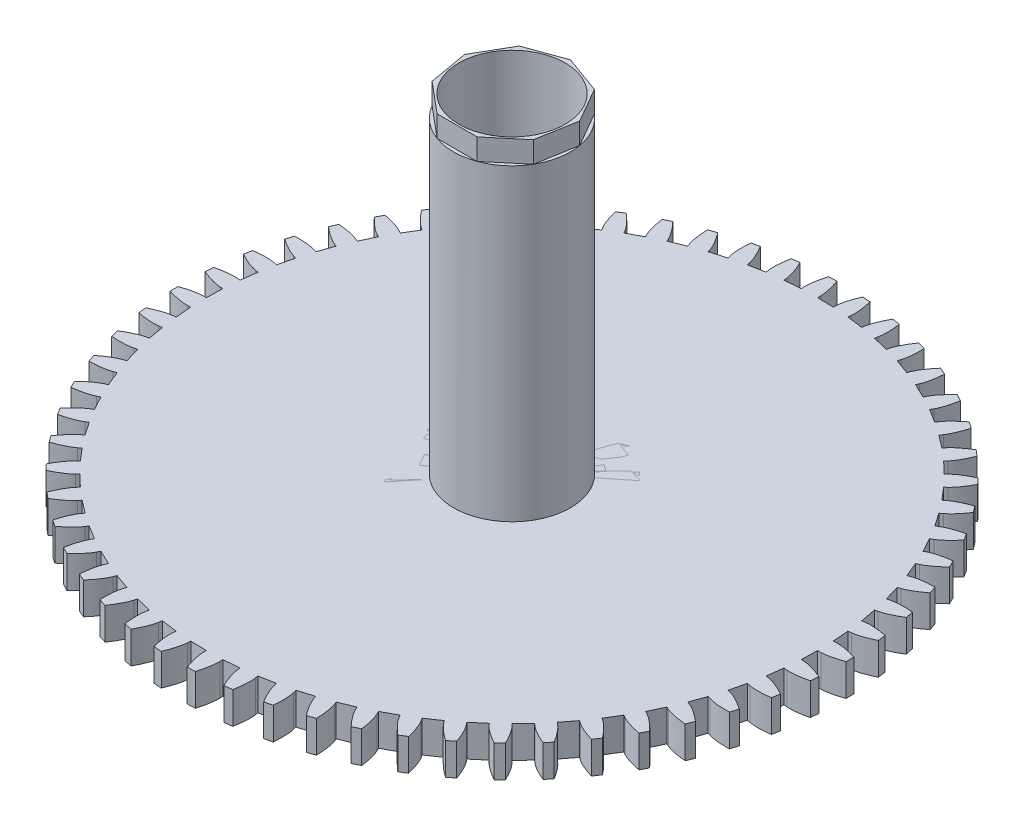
SolidWorks part; units mm, degrees
ref_plane "Front Plane" through (0, 0, 0) normal (0, 0, 1) x (1, 0, 0)
ref_plane "Top Plane" through (0, 0, 0) normal (0, 1, 0) x (1, 0, 0)
ref_plane "Right Plane" through (0, 0, 0) normal (1, 0, 0) x (0, 0, -1)
sketch "Sketch1" plane through (0, 0, 0) normal (0, 1, 0) x (1, 0, 0)
  line L0 (0, 0) -> (0, 14.5222) construction
  line L1 (0, 0) -> (-14.5222, 0) construction
  line L2 (0, 0) -> (-15.4947, -0.4057) construction
  line L3 (0, 0) -> (-14.5023, -0.76) construction
  line L4 (0, 0) -> (-14.4427, -1.518) construction
  circle A0 centre (0, 0) radius 15 construction
  circle A1 centre (0, 0) radius 14.5222 construction
  circle A2 centre (0, 0) radius 14.375 construction
  circle A3 centre (0, 0) radius 15.5 construction
  spline S0 degree 4 poles (-14.5222, 0) (-14.5474, 0) (-14.6179, -0.0026) (-14.7508, -0.0177) (-14.9656, -0.0568) (-15.2352, -0.1274) (-15.5771, -0.2425) (-15.9699, -0.4077) (-16.3888, -0.6197) (-16.8288, -0.8819) (-17.2522, -1.1709) (-17.6587, -1.4833) (-18.0484, -1.8162) (-18.5012, -2.2426) (-19.0162, -2.7882) (-19.5743, -3.4671) (-20.1529, -4.291) (-20.6802, -5.1708) (-21.1469, -6.0836) (-21.5035, -6.9074) (-21.773, -7.6266) (-21.9741, -8.236) (-22.1209, -8.7246) (-22.2874, -9.3478) (-22.4308, -9.9638) (-22.5527, -10.6055) (-22.6716, -11.3455) (-22.7509, -12.0161) (-22.806, -12.5943) (-22.8507, -13.4193) (-22.8604, -13.7954) (-22.8666, -14.374) (-22.8585, -14.6717) (-22.8548, -14.932) (-22.8482, -15.0561) (-22.8445, -15.1782) (-22.8421, -15.2291) knots 0 0 0 0 0 0.005377 0.015084 0.028532 0.04661 0.064855 0.092111 0.119476 0.146842 0.174209 0.201575 0.228941 0.256307 0.307035 0.361767 0.4165 0.471232 0.525964 0.580697 0.608063 0.635429 0.662795 0.690161 0.744894 0.77226 0.799626 0.854358 0.881725 0.909091 0.954545 0.965909 0.977273 0.988636 1 1 1 1 1 construction
  spline S1 degree 4 poles (-14.5222, 0) (-14.5474, 0) (-14.6179, -0.0026) (-14.7508, -0.0177) (-14.9656, -0.0568) (-15.2352, -0.1274) (-15.5771, -0.2425) (-15.9699, -0.4077) (-16.3888, -0.6197) (-16.8288, -0.8819) (-17.2522, -1.1709) (-17.6587, -1.4833) (-18.0484, -1.8162) (-18.5012, -2.2426) (-19.0162, -2.7882) (-19.5743, -3.4671) (-20.1529, -4.291) (-20.6802, -5.1708) (-21.1469, -6.0836) (-21.5035, -6.9074) (-21.773, -7.6266) (-21.9741, -8.236) (-22.1209, -8.7246) (-22.2874, -9.3478) (-22.4308, -9.9638) (-22.5527, -10.6055) (-22.6716, -11.3455) (-22.7509, -12.0161) (-22.806, -12.5943) (-22.8376, -13.1773) (-22.8474, -13.4103) (-22.8512, -13.5267) knots 0 0 0 0 0 0.005377 0.015084 0.028532 0.04661 0.064855 0.092111 0.119476 0.146842 0.174209 0.201575 0.228941 0.256307 0.307035 0.361767 0.4165 0.471232 0.525964 0.580697 0.608063 0.635429 0.662795 0.690161 0.744894 0.77226 0.799626 0.854358 0.881725 0.909091 0.909091 0.909091 0.909091 0.909091
  dimension "D1" = 31
  dimension "D2" = 30
  dimension "D3" = 29.0444
  dimension "D4" = 28.75
  dimension "D5" = 14.5222
  dimension "D6" = 1.5
  dimension "D7" = 3
  dimension "D8" = 6
sketch "Sketch2" plane through (0, 0, 0) normal (0, 1, 0) x (1, 0, 0)
  line L0 (0, 0) -> (-15.4947, -0.4057) construction
  line L1 (0, 0) -> (-15.4947, -0.4057) construction
  line L2 (0, 0) -> (-14.5023, -0.76) construction
  line L3 (0, 0) -> (-14.5222, 0) construction
  line L4 (0, 0) -> (-14.4427, -1.518) construction
  line L5 (0, 0) -> (-14.5023, -0.76) construction
  line L6 (0, 0) -> (-14.5222, 0) construction
  line L7 (0, 0) -> (-14.4427, -1.518) construction
  line L8 (-14.5023, -0.76) -> (-14.3553, -0.7523)
  line L9 (-14.3553, -0.7523) -> (-14.2963, -1.5026)
  line L10 (-14.2963, -1.5026) -> (-14.4427, -1.518) construction
  line L11 (-14.2963, -1.5026) -> (-2.4863, -0.2613)
  line L12 (-14.5222, 0) -> (-2.5, 0)
  circle A0 centre (0, 0) radius 14.375 construction
  circle A1 centre (0, 0) radius 14.5222 construction
  circle A2 centre (0, 0) radius 15 construction
  circle A3 centre (0, 0) radius 15.5 construction
  circle A4 centre (0, 0) radius 14.375 construction
  circle A5 centre (0, 0) radius 14.5222 construction
  circle A6 centre (0, 0) radius 15 construction
  circle A7 centre (0, 0) radius 15.5 construction
  arc A8 (-15.4887, -0.5918) -> (-15.4984, -0.2196) centre (0, 0) cw
  circle A11 centre (0, 0) radius 2.5 construction
  arc A12 (-2.5, 0) -> (-2.4863, -0.2613) centre (0, 0) ccw
  spline S0 degree 4 poles (-106.778, -2998.2103) (-10.1689, -57.3998) (-10.8164, -1.168) (-12.9959, 0.3015) (-14.9656, -0.0568) (-15.2352, -0.1274) (-15.5771, -0.2425) (-15.9699, -0.4077) (-16.3888, -0.6197) (-16.8288, -0.8819) (-17.2522, -1.1709) (-17.6587, -1.4833) (-18.0484, -1.8162) (-18.5012, -2.2426) (-19.0162, -2.7882) (-19.5743, -3.4671) (-20.1529, -4.291) (-20.6802, -5.1708) (-21.1469, -6.0836) (-21.5035, -6.9074) (-21.773, -7.6266) (-21.9741, -8.236) (-22.1209, -8.7246) (-22.2874, -9.3478) (-22.4308, -9.9638) (-22.5527, -10.6055) (-22.6716, -11.3455) (-22.7509, -12.0161) (-23.004, -14.671) (-22.8687, -20.8391) (-19.5685, 58.5384) (-120.7887, -3011.7811) knots -0.380873 -0.380873 -0.380873 -0.380873 -0.380873 0.005377 0.015084 0.028532 0.04661 0.064855 0.092111 0.119476 0.146842 0.174209 0.201575 0.228941 0.256307 0.307035 0.361767 0.4165 0.471232 0.525964 0.580697 0.608063 0.635429 0.662795 0.690161 0.744894 0.77226 0.799626 0.854358 0.881725 1.400556 1.400556 1.400556 1.400556 1.400556 only from (-14.5222, 0) to (-22.8512, -13.5267) construction
  spline S1 degree 4 poles (-14.5222, 0) (-14.5474, 0) (-14.6179, -0.0026) (-14.7508, -0.0177) (-14.9656, -0.0568) (-15.1845, -0.1141) (-15.3565, -0.1691) (-15.4674, -0.2083) (-15.4984, -0.2196) knots 0 0 0 0 0 0.005377 0.015084 0.028532 0.04661 0.053662 0.053662 0.053662 0.053662 0.053662
  spline S2 degree 4 poles (-14.5023, -0.76) (-14.5275, -0.7614) (-14.5981, -0.7625) (-14.7315, -0.7543) (-14.9481, -0.7266) (-15.1696, -0.6807) (-15.3443, -0.6348) (-15.4571, -0.6015) (-15.4887, -0.5918) knots 0 0 0 0 0 0.005377 0.015084 0.028532 0.04661 0.053662 0.053662 0.053662 0.053662 0.053662
  point P21 (-14.3553, -0.7523)
  point P24 (-14.2963, -1.5026)
  dimension "D2" = 5
extrude "Boss-Extrude1" add sketch "Sketch2" along normal blind 1.5
pattern_circular "CirPattern1" count 60 over 360 of "Boss-Extrude1"
sketch "Sketch3" plane through (0, 1.5, 0) normal (0, 1, 0) x (1, 0, 0)
  circle A0 centre (0, 0) radius 2.5
  circle A1 centre (0, 0) radius 2.75
  circle A2 centre (0, 0) radius 2.5 construction
  dimension "D1" = 0.25
extrude "Boss-Extrude2" add sketch "Sketch3" along normal blind 15.5
sketch "Sketch4" plane through (0, 17, 0) normal (0, 1, 0) x (1, 0, 0)
  line L0 (2.3816, -1.375) -> (2.7082, 0.4775)
  line L1 (0, 2.75) -> (-1.7677, 2.1066)
  line L2 (-1.7677, 2.1066) -> (-2.7082, 0.4775)
  line L3 (-2.7082, 0.4775) -> (-2.3816, -1.375)
  line L4 (-2.3816, -1.375) -> (-0.9406, -2.5842)
  line L5 (-0.9406, -2.5842) -> (0.9406, -2.5842)
  line L6 (0.9406, -2.5842) -> (2.3816, -1.375)
  line L7 (2.7082, 0.4775) -> (1.7677, 2.1066)
  line L8 (1.7677, 2.1066) -> (0, 2.75)
  circle A0 centre (0, 0) radius 2.75
  circle A1 centre (0, 0) radius 2.75 construction
extrude "Cut-Extrude2" cut sketch "Sketch4" against normal blind 1 contours L6 M1 | L0 M1 | L7 M1 | L5 M1 | L4 M1 | L3 M1 | L2 M1 | L1 M1 | L8 M1 | A0
equation "\"Module\"= .5"
equation "\"Number of Teeth\"= 60"
equation "\"Pressure Angle\"= 14.5deg"
equation "\"Pitch Diameter\"= \"Number of Teeth\" * \"Module\""
equation "\"Circular Pitch\"= pi * \"Module\""
equation "\"Addendum\"= \"Module\""
equation "\"Dedendum\"= 1.25 * \"Module\""
equation "\"Base Diameter\"= \"Pitch Diameter\" * cos ( \"Pressure Angle\" )"
equation "\"Base Radius\"= \"Base Diameter\" / 2"
equation "\"Width\"= 1.5"
equation "\"Outside Diameter\"= \"Pitch Diameter\" + 2 * \"Addendum\""
equation "\"D1@Sketch1\"=\"Outside Diameter\""
equation "\"D3@Sketch1\"=\"Base Diameter\""
equation "\"Root Diameter\"= \"Pitch Diameter\" - 2 * \"Dedendum\""
equation "\"D4@Sketch1\"=\"Root Diameter\""
equation "\"Tooth Angle\"= 360 / \"Number of Teeth\""
equation "\"D6@Sketch1\"=\"Tooth Angle\"/4"
equation "\"D7@Sketch1\"=\"Tooth Angle\"/2"
equation "\"D8@Sketch1\"=\"Tooth Angle\""
equation "\"D2@Sketch1\" = \"Pitch Diameter\""
equation "\"Shaft Diameter\"= 5"
equation "\"D1@CirPattern1\" = \"Number of Teeth\""
equation "\"D2@Sketch2\"= \"Shaft Diameter\""
equation "\"D1@Boss-Extrude1\" = \"Width\""
